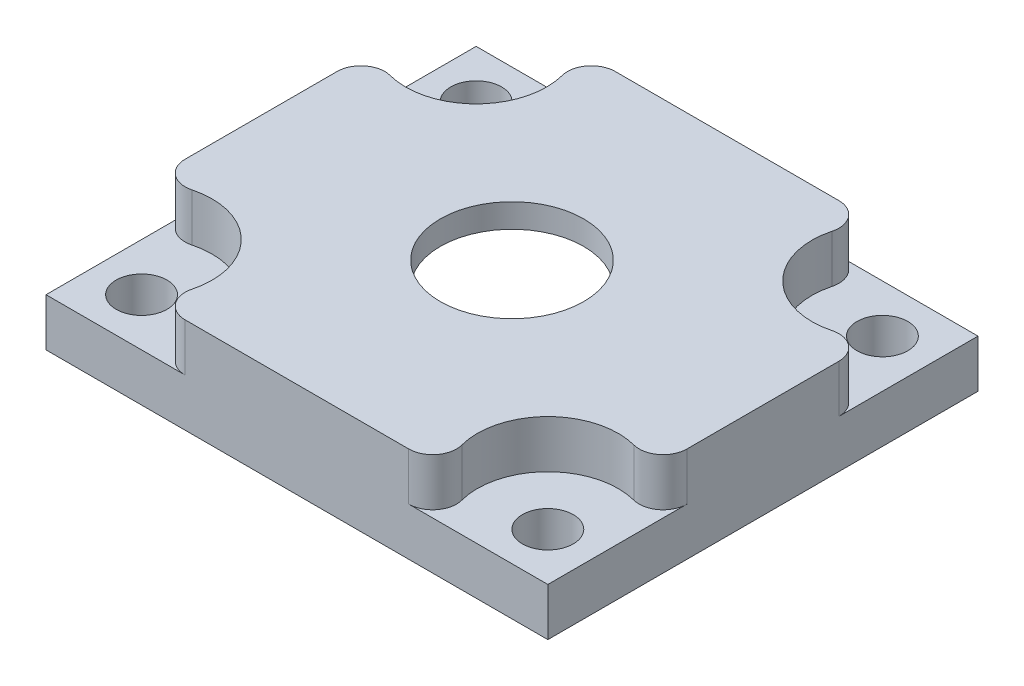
SolidWorks part; units mm, degrees
ref_plane "Front" through (0, 0, 0) normal (0, 0, 1) x (1, 0, 0)
ref_plane "Top" through (0, 0, 0) normal (0, 1, 0) x (1, 0, 0)
ref_plane "Right" through (0, 0, 0) normal (1, 0, 0) x (0, 0, -1)
sketch "Sketch1" plane through (0, 0, 0) normal (0, 1, 0) x (1, 0, 0)
  line L1 (-33.3375, -28.575) -> (33.3375, -28.575)
  line L2 (-33.3375, -28.575) -> (-33.3375, 28.575)
  line L3 (-33.3375, 28.575) -> (33.3375, 28.575)
  line L4 (33.3375, -28.575) -> (33.3375, 28.575)
  line L5 (-33.3375, -28.575) -> (33.3375, 28.575) construction
  line L6 (-33.3375, 28.575) -> (33.3375, -28.575) construction
  point P0 (0, 0)
  dimension "D1" = 57.15
  dimension "D2" = 66.675
extrude "Boss-Extrude1" add sketch "Sketch1" along normal blind 12.7
sketch "Sketch4" plane through (0, 12.7, 0) normal (0, 1, 0) x (1, 0, 0)
  line L1 (-26.9875, 22.225) -> (26.9875, 22.225)
  line L2 (-26.9875, 22.225) -> (-26.9875, -22.225)
  line L3 (-26.9875, -22.225) -> (26.9875, -22.225)
  line L4 (26.9875, 22.225) -> (26.9875, -22.225)
  line L5 (33.3375, 28.575) -> (-33.3375, 28.575) construction
  line L6 (-33.3375, 28.575) -> (-33.3375, -28.575) construction
  point P96 (0, 22.225)
  point P98 (26.9875, 0)
  dimension "D1" = 6.35
  dimension "D2" = 6.35
hole_wizard "CBORE for 1/4 Socket Head Cap Screw1" positions "Sketch4" profile "Sketch3" counterbore size "1/4" standard "ANSI Inch"
sketch "Sketch3" plane through (-26.9875, 12.7, -22.225) normal (1, 0, 0) x (0, 0, 1)
  line L0 (0, 0) -> (0, 12.7)
  line L1 (0, 12.7) -> (3.3782, 12.7)
  line L3 (3.3782, 12.7) -> (3.3782, 6.35)
  line L4 (3.3782, 6.35) -> (9.3662, 6.35)
  line L5 (9.3662, 6.35) -> (9.3662, 0)
  line L7 (9.3662, 0) -> (0, 0)
  line L11 (0, -6.35) -> (0, 107.95) construction
  dimension "Thru Hole Dia." = 6.7564
  dimension "Thru Hole Depth" = 12.7
  dimension "C'Bore Dia." = 18.7325
  dimension "C'Bore Depth" = 6.35
fillet "Fillet1" radius 3.175 8 edges at (-20.1024, 9.525, -28.575) (-33.3375, 9.525, -15.3399) (33.3375, 9.525, -15.3399) (20.1024, 9.525, -28.575) (33.3375, 9.525, 15.3399) (20.1024, 9.525, 28.575) (-33.3375, 9.525, 15.3399) (-20.1024, 9.525, 28.575)
shell "Shell1" thickness 3.175
sketch "Sketch5" plane through (0, 12.7, 0) normal (0, 1, 0) x (1, 0, 0)
  circle A0 centre (0, 0) radius 9.525
  dimension "D1" = 19.05
extrude "Cut-Extrude1" cut sketch "Sketch5" against normal through all
